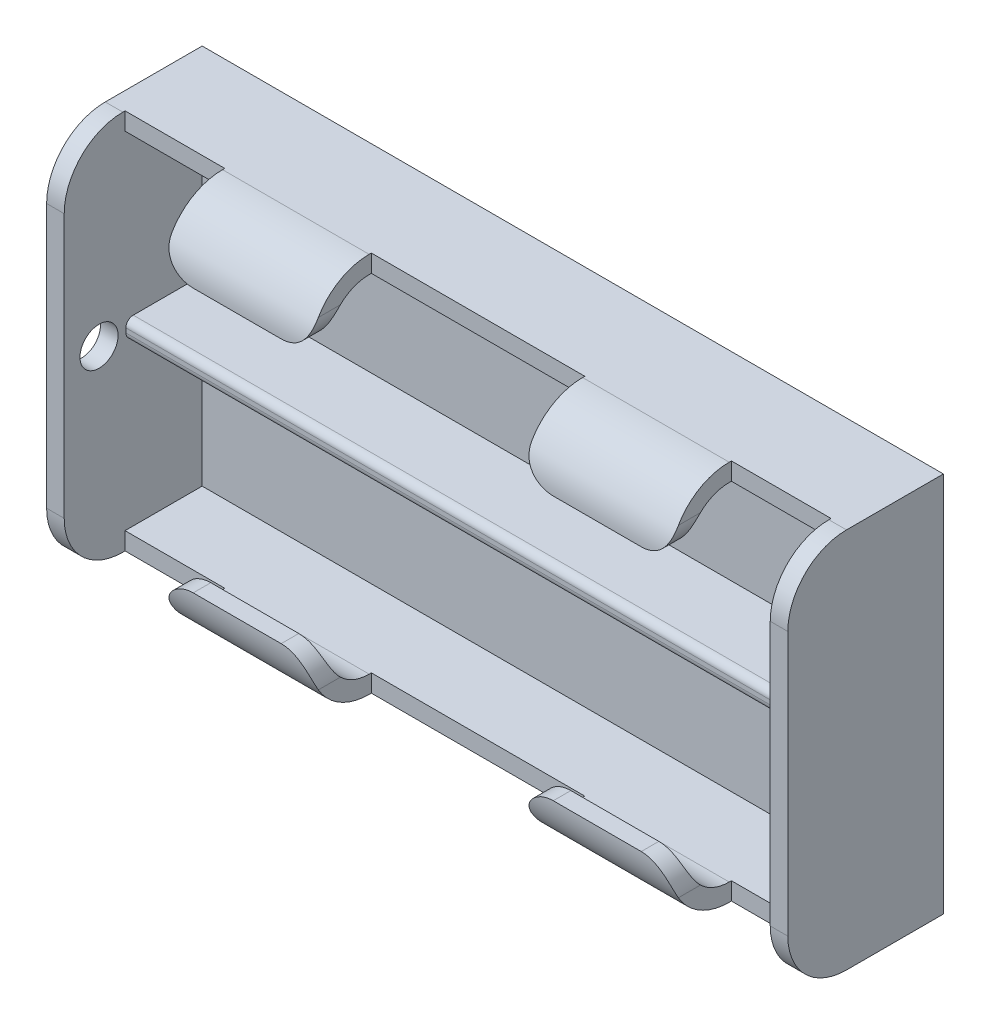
SolidWorks part; units mm, degrees
ref_plane "Face" through (0, 0, 0) normal (0, 0, 1) x (1, 0, 0)
ref_plane "Dessus" through (0, 0, 0) normal (0, 1, 0) x (1, 0, 0)
ref_plane "Droite" through (0, 0, 0) normal (1, 0, 0) x (0, 0, -1)
sketch "Esquisse1" plane through (0, 0, 0) normal (0, 0, 1) x (1, 0, 0)
  line L1 (0, 0) -> (50.56, 0)
  line L2 (0, 0) -> (0, 26)
  line L3 (0, 26) -> (50.56, 26)
  line L4 (50.56, 0) -> (50.56, 26)
  dimension "D1" = 50.56
  dimension "D2" = 26
extrude "Base-Extrusion" add sketch "Esquisse1" against normal blind 10.61
fillet "Congé1" radius 4
shell "Coque1" thickness 1.2
sketch "Esquisse2" plane through (0, 0, 0) normal (0, 0, 1) x (1, 0, 0)
  line L0 (1.8981, 26) -> (52.8187, 26) construction
  line L1 (1.2, 24.8) -> (49.36, 24.8) construction
  line L2 (1.2, 24.8) -> (1.2, 1.2) construction
  line L3 (1.2, 1.2) -> (49.36, 1.2) construction
  line L4 (49.36, 1.2) -> (49.36, 24.8) construction
  line L5 (8, 29.9549) -> (8, -5.9984) construction
  line L6 (18, 29.9549) -> (18, -3.6994) construction
  line L7 (25.28, 33.2756) -> (25.28, -6.0623) construction
  line L8 (4.4734, 23) -> (19.289, 23) construction
  line L9 (-2.1681, 13) -> (51.7938, 13) construction
  line L10 (1.2, 1.2) -> (1.2, 24.8)
  line L11 (1.2, 24.8) -> (8, 24.8)
  line L12 (8, 24.8) -> (8, 21.6177)
  line L13 (8, 21.6177) -> (18, 21.6177)
  line L14 (18, 21.6177) -> (18, 24.8)
  line L15 (18, 24.8) -> (32.56, 24.8)
  line L16 (32.56, 21.6177) -> (32.56, 24.8)
  line L17 (42.56, 21.6177) -> (32.56, 21.6177)
  line L18 (42.56, 24.8) -> (42.56, 21.6177)
  line L19 (49.36, 24.8) -> (42.56, 24.8)
  line L20 (49.36, 1.2) -> (49.36, 24.8)
  line L21 (1.2, 1.2) -> (8, 1.2)
  line L22 (8, 1.2) -> (8, 4.3823)
  line L23 (8, 4.3823) -> (18, 4.3823)
  line L24 (18, 4.3823) -> (18, 1.2)
  line L25 (18, 1.2) -> (32.56, 1.2)
  line L26 (32.56, 4.3823) -> (32.56, 1.2)
  line L27 (42.56, 4.3823) -> (32.56, 4.3823)
  line L28 (42.56, 1.2) -> (42.56, 4.3823)
  line L29 (49.36, 1.2) -> (42.56, 1.2)
  point P23 (25.28, 24.8)
  point P24 (25.28, 24.8)
  point P27 (49.36, 13)
  point P29 (1.2, 13)
  point P35 (1.2, 13)
  point P38 (49.36, 13)
extrude "Enlèv. mat.-Extru.1" cut sketch "Esquisse2" against normal blind 9.4
sketch "Esquisse3" plane through (0, 0, -9.41) normal (0, 0, 1) x (1, 0, 0)
  line L0 (-1.3418, 13) -> (52.5131, 13) construction
  line L1 (49.4809, 12.35) -> (49.4809, 13.65)
  line L2 (1.0423, 12.35) -> (49.4809, 12.35)
  line L3 (1.0423, 13.65) -> (49.4809, 13.65)
  line L4 (1.0423, 13.65) -> (1.0423, 12.35)
extrude "Boss.-Extru.1" add sketch "Esquisse3" along normal blind 5.2
fillet "Congé2" radius 0.5
fillet "Congé3" radius 2
sketch "Esquisse4" plane through (0, 0, 0) normal (0, 0, 1) x (1, 0, 0)
  line L0 (1.2, 29.0464) -> (1.2, -4.269) construction
  line L1 (8, -3.2909) -> (8, 30.758) construction
  line L2 (18, -4.269) -> (18, 30.758) construction
  line L3 (32.56, -2.1906) -> (32.56, 29.9634) construction
  line L4 (42.56, -4.269) -> (42.56, 31.3082) construction
  line L5 (-1.4029, 24.8) -> (52.5742, 24.8) construction
  line L6 (49.36, 29.0464) -> (49.36, -5.4916) construction
  line L7 (51.9629, 1.2) -> (-1.8308, 1.2) construction
  line L8 (1.2, 27.3959) -> (8, 27.3959)
  line L9 (8, 27.3959) -> (8, 19.6325)
  line L10 (8, 19.6325) -> (18, 19.6325)
  line L11 (18, 19.6325) -> (18, 28.4963)
  line L12 (18, 28.4963) -> (32.56, 28.4963)
  line L13 (32.56, 28.4963) -> (32.56, 20.6106)
  line L14 (32.56, 20.6106) -> (42.56, 20.6106)
  line L15 (42.56, 20.6106) -> (42.56, 29.0464)
  line L16 (42.56, 29.0464) -> (49.36, 28.4963)
  line L17 (49.36, 28.4963) -> (49.36, -2.6797)
  line L18 (49.36, -2.6797) -> (42.56, -2.6797)
  line L19 (42.56, -2.6797) -> (42.56, 6.9788)
  line L20 (42.56, 6.9788) -> (32.56, 6.9788)
  line L21 (32.56, 6.9788) -> (32.56, -0.968)
  line L22 (32.56, -0.968) -> (18, -0.968)
  line L23 (18, -0.968) -> (18, 5.7562)
  line L24 (18, 5.7562) -> (8, 5.7562)
  line L25 (8, 5.7562) -> (8, -1.6405)
  line L26 (8, -1.6405) -> (1.2, -1.6405)
  line L27 (1.2, -1.6405) -> (1.2, 27.3959)
extrude "Enlèv. mat.-Extru.2" cut sketch "Esquisse4" against normal blind 4.15
sketch "Esquisse5" plane through (0, 0, 0) normal (-1, 0, 0) x (0, 0, 1)
  circle A0 centre (-2.3764, 12.9801) radius 1.3
extrude "Enlèv. mat.-Extru.3" cut sketch "Esquisse5" against normal blind 3
